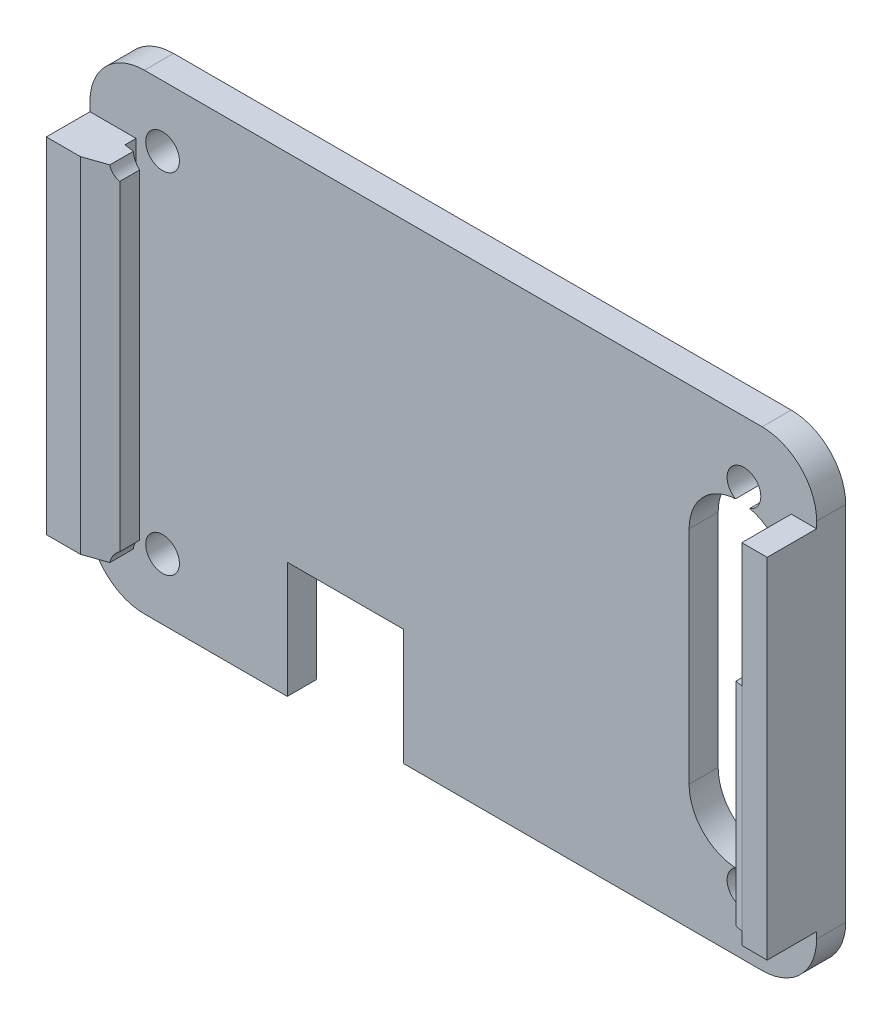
SolidWorks part; units mm, degrees
ref_plane "Front" through (0, 0, 0) normal (0, 0, 1) x (1, 0, 0)
ref_plane "Top" through (0, 0, 0) normal (0, 1, 0) x (1, 0, 0)
ref_plane "Right" through (0, 0, 0) normal (1, 0, 0) x (0, 0, -1)
sketch "Sketch1" plane through (0, 0, 0) normal (0, 0, 1) x (1, 0, 0)
  line L0 (0, 0) -> (31.75, 0) construction
  line L1 (-31.75, -20.574) -> (31.75, -20.574)
  line L2 (-31.75, -20.574) -> (-31.75, 20.574)
  line L3 (-31.75, 20.574) -> (31.75, 20.574)
  line L4 (31.75, -20.574) -> (31.75, 20.574)
  line L5 (0, 0) -> (0, -20.574) construction
  dimension "D1" = 41.148
  dimension "D2" = 63.5
extrude "Boss-Extrude1" add sketch "Sketch1" along normal blind 2.54
sketch "Sketch2" plane through (0, 0, 2.54) normal (0, 0, 1) x (1, 0, 0)
  line L0 (-26.2128, 0) -> (0, 0) construction
  line L1 (-31.75, 15.0495) -> (-26.2128, 15.0495)
  line L2 (-31.75, 15.0495) -> (-31.75, -15.0495)
  line L3 (-31.75, -15.0495) -> (-26.2128, -15.0495)
  line L4 (-26.2128, 15.0495) -> (-26.2128, -15.0495)
  line L5 (-31.75, 20.574) -> (-31.75, -20.574) construction
  dimension "D1" = 30.099
  dimension "D2" = 5.5372
extrude "Boss-Extrude2" add sketch "Sketch2" along normal blind 3.81
sketch "Sketch3" plane through (0, 0, 0) normal (0, 1, 0) x (1, 0, 0)
  line L0 (-26.2128, -2.54) -> (-27.7114, -2.54)
  line L1 (-26.2128, -2.54) -> (-31.75, -2.54) construction
  line L2 (-27.7114, -2.54) -> (-27.7114, -3.5098)
  line L3 (-27.7114, -3.5098) -> (-26.2128, -3.7369)
  line L4 (-26.2128, -6.35) -> (-26.2128, -2.54) construction
  line L5 (-26.2128, -3.7369) -> (-26.2128, -2.54)
  line L6 (-26.2128, -5.4644) -> (-28.771, -6.35)
  line L7 (-26.2128, -6.35) -> (-31.75, -6.35) construction
  line L8 (-28.771, -6.35) -> (-26.2128, -6.35)
  line L9 (-26.2128, -6.35) -> (-26.2128, -5.4644)
  dimension "D1" = 27.7114
extrude "Cut-Extrude1" cut sketch "Sketch3" against normal through all both and the other way through all
fillet "Fillet1" radius 4.7625 4 edges at (-31.75, -20.574, 1.27) (31.75, -20.574, 1.27) (31.75, 20.574, 1.27) (-31.75, 20.574, 1.27)
sketch "Sketch4" plane through (0, 0, 2.54) normal (0, 0, 1) x (1, 0, 0)
  line L0 (-26.9875, -20.574) -> (26.9875, -20.574) construction
  line L1 (-14.5034, -20.574) -> (-4.3434, -20.574)
  line L2 (-14.5034, -20.574) -> (-14.5034, -10.414)
  line L3 (-14.5034, -10.414) -> (-4.3434, -10.414)
  line L4 (-4.3434, -20.574) -> (-4.3434, -10.414)
  line L5 (-27.7114, -15.0495) -> (-27.7114, 15.0495) construction
  dimension "D1" = 10.16
  dimension "D2" = 10.16
  dimension "D3" = 13.208
extrude "Cut-Extrude2" cut sketch "Sketch4" against normal blind 4.318
sketch "Sketch5" plane through (0, 0, 0) normal (0, 0, -1) x (-1, 0, 0)
  line L0 (-24.9129, 9.6644) -> (-24.9129, -9.6644) construction
  line L1 (-20.6068, 9.6644) -> (-20.6068, -9.6644)
  line L2 (-29.219, 9.6644) -> (-29.219, -9.6644)
  line L3 (0, 0) -> (-24.9129, 0) construction
  arc A0 (-20.6068, 9.6644) -> (-29.219, 9.6644) centre (-24.9129, 9.6644) ccw
  arc A1 (-29.219, -9.6644) -> (-20.6068, -9.6644) centre (-24.9129, -9.6644) ccw
  point P2 (-24.9129, 0)
  dimension "D1" = 24.9129
extrude "Cut-Extrude3" cut sketch "Sketch5" against normal blind 4.318
sketch "Sketch6" plane through (0, 0, 2.54) normal (0, 0, 1) x (1, 0, 0)
  line L0 (29.5313, -15.24) -> (29.5313, 15.24)
  line L1 (29.5313, 15.24) -> (31.75, 15.24)
  line L2 (31.75, -15.8115) -> (31.75, 15.8115) construction
  line L3 (31.75, 15.24) -> (31.75, -15.24)
  line L4 (31.75, -15.24) -> (29.5313, -15.24)
  line L5 (0, 0) -> (29.5313, 0) construction
  dimension "D1" = 30.48
extrude "Boss-Extrude3" add sketch "Sketch6" along normal blind 4.318
ref_plane "Plane1" through (0, -4.8895, 0) normal (0, -1, 0) x (-1, 0, 0)
sketch "Sketch8" plane through (0, -4.8895, 0) normal (0, -1, 0) x (-1, 0, 0)
  line L0 (-29.5313, -5.461) -> (-28.8963, -5.7177)
  line L1 (-29.5313, -6.858) -> (-29.5313, -2.54) construction
  line L2 (-28.8963, -5.7177) -> (-28.8963, -6.7127)
  line L3 (-28.8963, -6.7127) -> (-29.5313, -6.858)
  line L4 (-31.75, -2.54) -> (-26.9875, -2.54) construction
  line L9 (-29.5313, -2.54) -> (-31.75, -2.54)
  line L10 (-31.75, -2.54) -> (-31.75, -6.858)
  line L11 (-31.75, -6.858) -> (-29.5313, -6.858)
  line L12 (-29.5313, -6.858) -> (-29.5313, -2.54)
  line L13 (-29.5313, -2.54) -> (-31.75, -2.54)
  line L14 (-31.75, -2.54) -> (-31.75, -6.858)
  line L15 (-31.75, -6.858) -> (-29.5313, -6.858)
  line L16 (-29.5313, -5.461) -> (-29.5313, -2.54)
  dimension "D1" = 0.635
  dimension "D2" = 2.921
  dimension "D3" = 0
extrude "Boss-Extrude4" add sketch "Sketch8" along normal mid plane 18.542
hole_wizard "#4 Clearance Hole1" positions "Sketch11" profile "Sketch10" hole size "#4" standard "ANSI Inch"
sketch "Sketch11" plane through (0, 0, 0) normal (0, 0, -1) x (-1, 0, 0)
  line L1 (-25.4, 15.24) -> (25.4, 15.24)
  line L2 (-25.4, 15.24) -> (-25.4, -15.24)
  line L3 (-25.4, -15.24) -> (25.4, -15.24)
  line L4 (25.4, 15.24) -> (25.4, -15.24)
  line L5 (0, 0) -> (25.4, 0) construction
  line L8 (0, 0) -> (0, 15.24) construction
  point P0 (-25.4, 15.24)
  point P1 (25.4, -15.24)
  point P164 (-25.4, -15.24)
  point P165 (25.4, 15.24)
  dimension "D1" = 50.8
  dimension "D2" = 30.48
sketch "Sketch10" plane through (25.4, 15.24, 0) normal (1, 0, 0) x (0, 1, 0)
  line L0 (0, 0) -> (0, 6.858)
  line L1 (0, 6.858) -> (1.4732, 6.858)
  line L2 (1.4732, 6.858) -> (1.4732, 0)
  line L5 (1.4732, 0) -> (0, 0)
  line L11 (0, -6.35) -> (0, 107.95) construction
  dimension "Thru Hole Dia." = 2.9464
  dimension "Thru Hole Depth" = 6.858
